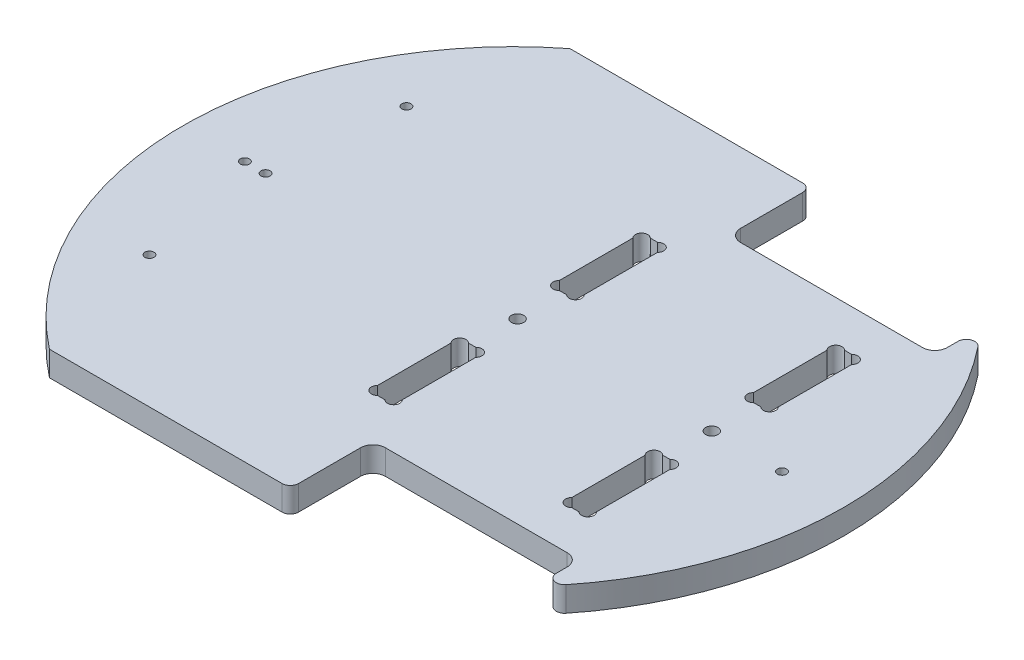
SolidWorks part; units mm, degrees
ref_plane "Plan de face" through (0, 0, 0) normal (0, 0, 1) x (1, 0, 0)
ref_plane "Plan de dessus" through (0, 0, 0) normal (0, 1, 0) x (1, 0, 0)
ref_plane "Plan de droite" through (0, 0, 0) normal (1, 0, 0) x (0, 0, -1)
sketch "Esquisse1" plane through (0, 0, 0) normal (0, 1, 0) x (1, 0, 0)
  line L0 (-111.0793, 0) -> (144.6389, 0) construction
  line L1 (-20.6986, 33) -> (85.418, 33) construction
  line L2 (-20.6986, -33) -> (85.418, -33) construction
  line L3 (26.6734, 11) -> (46.2981, 11) construction
  line L4 (6.7162, 22) -> (41.0825, 22) construction
  line L5 (36, 33) -> (21.3134, 18.3134) construction
  line L6 (33, 23.7409) -> (33, -5.0055) construction
  line L7 (32.1213, 33) -> (33.8787, 33)
  line L8 (36, 30.8787) -> (36, 13.1213)
  line L9 (9.5, 3.0693) -> (9.5, -28.2202) construction
  line L10 (33.8787, 11) -> (32.1213, 11)
  line L11 (30, 13.1213) -> (30, 30.8787)
  line L12 (33.8787, -11) -> (32.1213, -11)
  line L13 (69.2532, -43) -> (-30.869, -43) construction
  line L14 (36, -93.4535) -> (36, 65.2255) construction
  line L15 (-16, -93.4535) -> (-16, -38.6395) construction
  line L16 (-111.0793, -63) -> (69.2583, -63) construction
  line L17 (-64.3052, -63) -> (-8, -63)
  line L18 (36, -30.8787) -> (36, -13.1213)
  line L19 (-6, 61) -> (-6, 46)
  line L20 (44, 65.2255) -> (44, -79.7039) construction
  line L21 (-3, -43) -> (41, -43)
  line L22 (30, -13.1213) -> (30, -30.8787)
  line L23 (44, -46) -> (44, -48.6107)
  line L24 (-3, 43) -> (41, 43)
  line L25 (-6, -46) -> (-6, -61)
  line L26 (-64.3052, 63) -> (-8, 63)
  line L27 (32.1213, -33) -> (33.8787, -33)
  line L28 (-13.1213, -33) -> (-14.8787, -33)
  line L29 (-11, -13.1213) -> (-11, -30.8787)
  line L30 (-17, -30.8787) -> (-17, -13.1213)
  line L31 (-14.8787, -11) -> (-13.1213, -11)
  line L32 (-11, 13.1213) -> (-11, 30.8787)
  line L33 (-14.8787, 11) -> (-13.1213, 11)
  line L34 (-80, -11.2854) -> (-80, 32.0047) construction
  line L35 (-95, 32.0044) -> (-95, -4) construction
  line L36 (30, 61) -> (30, -53.2123) construction
  line L37 (-17, 30.8787) -> (-17, 13.1213)
  line L38 (-13.1213, 33) -> (-14.8787, 33)
  line L39 (65, -28.2202) -> (65, 30.8787) construction
  line L40 (50, -28.2202) -> (50, 28.7239) construction
  line L41 (44, 46) -> (44, 48.6108)
  line L42 (-6, 68.0469) -> (-6, -79.7039) construction
  line L46 (-75, 32.0047) -> (-75, -11.2854) construction
  arc A0 (-3, 43) -> (-6, 46) centre (-3, 46) cw
  arc A1 (36, 30.8787) -> (33.8787, 33) centre (34.9393, 31.9393) ccw
  arc A2 (30, 30.8787) -> (32.1213, 33) centre (31.0607, 31.9393) cw
  arc A3 (36, 13.1213) -> (33.8787, 11) centre (34.9393, 12.0607) cw
  arc A4 (30, 13.1213) -> (32.1213, 11) centre (31.0607, 12.0607) ccw
  arc A5 (30, -13.1213) -> (32.1213, -11) centre (31.0607, -12.0607) cw
  arc A6 (36, -13.1213) -> (33.8787, -11) centre (34.9393, -12.0607) ccw
  arc A7 (30, -30.8787) -> (32.1213, -33) centre (31.0607, -31.9393) ccw
  arc A8 (36, -30.8787) -> (33.8787, -33) centre (34.9393, -31.9393) cw
  arc A9 (47.5641, -49.8571) -> (47.5641, 49.8572) centre (-15, 0) ccw
  arc A10 (-64.3052, 63) -> (-64.3052, -63) centre (-15, 0) ccw
  arc A11 (-3, -43) -> (-6, -46) centre (-3, -46) ccw
  arc A12 (41, 43) -> (44, 46) centre (41, 46) ccw
  arc A13 (-8, 63) -> (-6, 61) centre (-8, 61) cw
  arc A14 (-17, -30.8787) -> (-14.8787, -33) centre (-15.9393, -31.9393) ccw
  arc A15 (-11, -30.8787) -> (-13.1213, -33) centre (-12.0607, -31.9393) cw
  arc A16 (-17, -13.1213) -> (-14.8787, -11) centre (-15.9393, -12.0607) cw
  arc A17 (-11, -13.1213) -> (-13.1213, -11) centre (-12.0607, -12.0607) ccw
  circle A18 centre (-80, 0) radius 1.1
  arc A19 (-11, 13.1213) -> (-13.1213, 11) centre (-12.0607, 12.0607) cw
  arc A20 (-17, 13.1213) -> (-14.8787, 11) centre (-15.9393, 12.0607) ccw
  arc A21 (-11, 30.8787) -> (-13.1213, 33) centre (-12.0607, 31.9393) ccw
  circle A22 centre (-80, 0) radius 9 construction
  arc A23 (-17, 30.8787) -> (-14.8787, 33) centre (-15.9393, 31.9393) cw
  circle A24 centre (50, 0) radius 1.1
  arc A25 (41, -43) -> (44, -46) centre (41, -46) cw
  circle A26 centre (33, 0) radius 1.5
  circle A27 centre (-15, 0) radius 79 construction
  circle A28 centre (-75, 0) radius 1.1
  arc A29 (44, -48.6107) -> (47.5641, -49.8571) centre (46, -48.6107) ccw
  arc A30 (-8, -63) -> (-6, -61) centre (-8, -61) ccw
  arc A31 (44, 48.6108) -> (47.5641, 49.8572) centre (46, 48.6108) cw
  circle A33 centre (-14, 0) radius 1.5
  circle A34 centre (-72, -31.1) radius 1.1
  circle A35 centre (-72, 31.1) radius 1.1
  point P69 (36, -61.636)
  point P121 (44, -54.0278)
  point P124 (44, 54.0279)
  dimension "D8" = 45
  dimension "D9" = 11
  dimension "D13" = 52
  dimension "D12" = 15
  dimension "D16" = 3
  dimension "D23" = 15
  dimension "D34" = 20
  dimension "D11" = 3
  dimension "D14" = 8
  dimension "D17" = 2
  dimension "D18" = 50
  dimension "D19" = 3
  dimension "D20" = 2
  dimension "D4" = 6
  dimension "D5" = 66
  dimension "D6" = 33
  dimension "D7" = 20.5
  dimension "D10" = 22
  dimension "D15" = 20
extrude "Extrusion1" add sketch "Esquisse1" along normal blind 6
